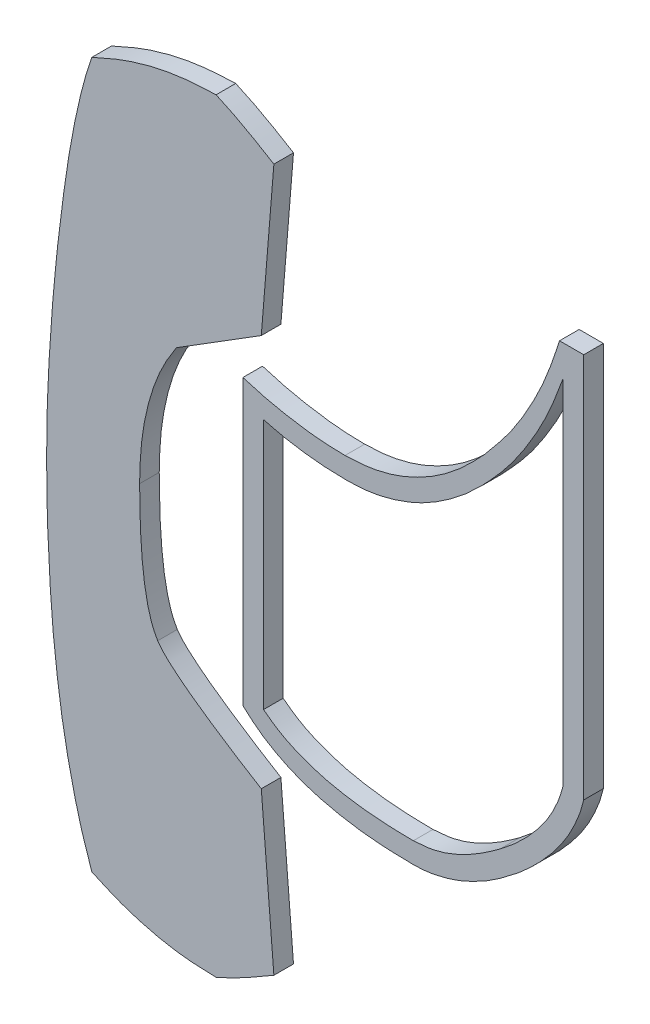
SolidWorks part; units mm, degrees
ref_plane "vorn" through (0, 0, 0) normal (0, 0, 1) x (1, 0, 0)
ref_plane "oben" through (0, 0, 0) normal (0, 1, 0) x (1, 0, 0)
ref_plane "rechts" through (0, 0, 0) normal (1, 0, 0) x (0, 0, -1)
sketch "Skizze1"
extrude "Linear austragen1" add sketch "Skizze1" along normal blind 1
